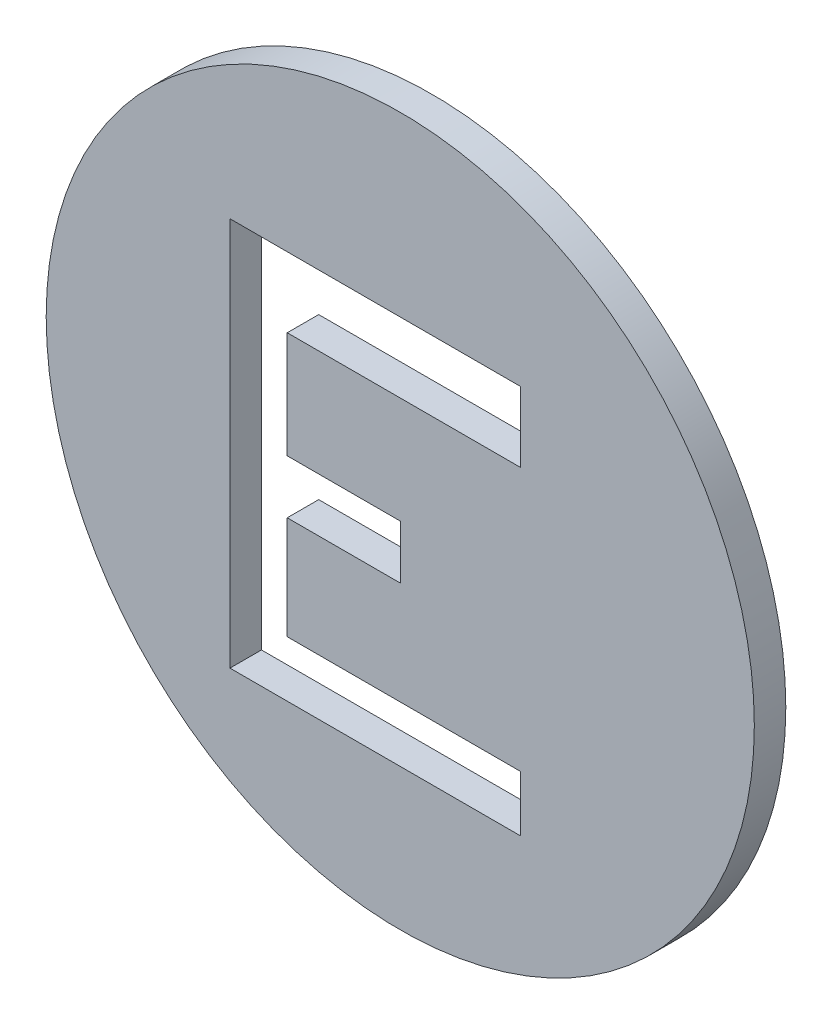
SolidWorks part; units mm, degrees
ref_plane "Front Plane" through (0, 0, 0) normal (0, 0, 1) x (1, 0, 0)
ref_plane "Top Plane" through (0, 0, 0) normal (0, 1, 0) x (1, 0, 0)
ref_plane "Right Plane" through (0, 0, 0) normal (1, 0, 0) x (0, 0, -1)
sketch "Sketch1" plane through (0, 0, 0) normal (0, 0, 1) x (1, 0, 0)
  circle A0 centre (0, 0) radius 45
  dimension "D1" = 90
extrude "Boss-Extrude1" add sketch "Sketch1" along normal blind 4
sketch "Sketch2" plane through (0, 0, 4) normal (0, 0, 1) x (1, 0, 0)
  line L0 (15.2749, 22.4577) -> (-21.6395, 22.4577)
  line L1 (-21.6395, 22.4577) -> (-21.6395, -27.0039)
  line L2 (-21.6395, -27.0039) -> (15.2749, -27.0039)
  line L3 (15.2749, 22.4577) -> (15.2749, 13.5474)
  line L4 (15.2749, 13.5474) -> (-14.3657, 13.5474)
  line L5 (-14.3657, 13.5474) -> (-14.3657, 0)
  line L6 (-14.3657, 0) -> (0, 0)
  line L7 (0, 0) -> (0, -6.8192)
  line L8 (0, -6.8192) -> (-14.3657, -6.8192)
  line L9 (-14.3657, -6.8192) -> (-14.3657, -19.9119)
  line L10 (-14.3657, -19.9119) -> (15.2749, -19.9119)
  line L11 (15.2749, -19.9119) -> (15.2749, -27.0039)
extrude "Cut-Extrude1" cut sketch "Sketch2" against normal blind 4
